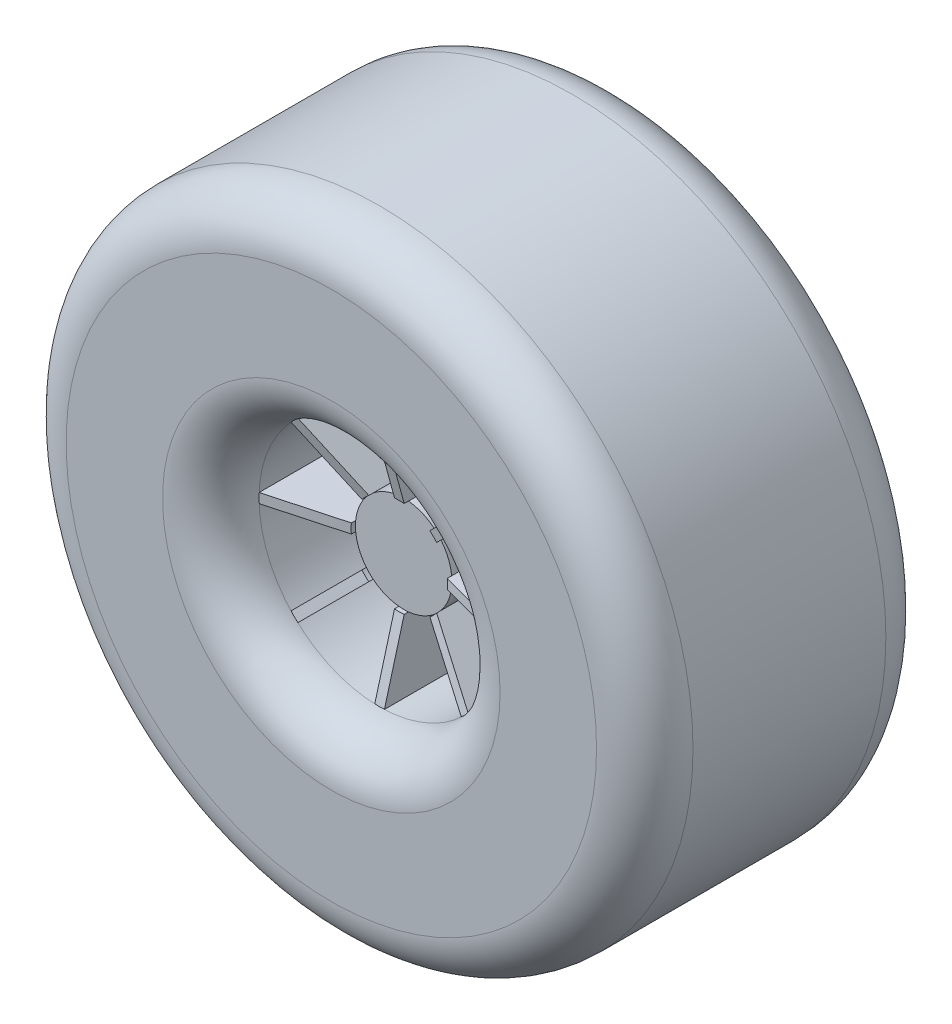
SolidWorks part; units mm, degrees
ref_plane "前视基准面" through (0, 0, 0) normal (0, 0, 1) x (1, 0, 0)
ref_plane "上视基准面" through (0, 0, 0) normal (0, 1, 0) x (1, 0, 0)
ref_plane "右视基准面" through (0, 0, 0) normal (1, 0, 0) x (0, 0, -1)
sketch "草图1" plane through (0, 0, 0) normal (0, 0, 1) x (1, 0, 0)
  circle A0 centre (0, 0) radius 65
  dimension "D1" = 130
extrude "凸台-拉伸1" add sketch "草图1" along normal mid plane 60
sketch "草图4" plane through (0, 0, 30) normal (0, 0, 1) x (1, 0, 0)
  circle A0 centre (0, 0) radius 25
  dimension "D1" = 50
extrude "切除-拉伸1" cut sketch "草图4" against normal blind 60
fillet "圆角1" radius 10 4 edges at (25, 0, -30) (65, 0, -30) (25, 0, 30) (65, 0, 30)
sketch "草图6" plane through (0, 0, 0) normal (0, 0, 1) x (1, 0, 0)
  circle A0 centre (0, 0) radius 10
  dimension "D1" = 20
extrude "凸台-拉伸2" add sketch "草图6" along normal mid plane 30 separate body
sketch "草图7" plane through (0, 0, 0) normal (0, 1, 0) x (1, 0, 0)
  line L0 (-6.6667, 13.5296) -> (-6.6667, -13.5296)
  line L1 (10, 15) -> (-10, 15) construction
  line L2 (-10, -15) -> (10, -15) construction
  line L3 (-10.2561, -15.9789) -> (-22.3772, -19.2847)
  line L4 (65, -20) -> (-65, -20) construction
  line L5 (25, -20) -> (-25, -20) construction
  line L6 (-25, -17.2796) -> (-25, 17.2796)
  line L7 (25, 20) -> (-25, 20) construction
  line L8 (-22.3772, 19.2847) -> (-10.2561, 15.9789)
  line L9 (0, 0) -> (-6.6667, 0) construction
  line L10 (-22.3772, -19.2847) -> (-25, -20)
  line L11 (-25, -20) -> (-25, -17.2796)
  line L12 (-10.2561, -15.9789) -> (-6.6667, -15)
  line L13 (-6.6667, -15) -> (-6.6667, -13.5296)
  line L14 (-6.6667, 13.5296) -> (-6.6667, 15)
  line L15 (-6.6667, 15) -> (-10.2561, 15.9789)
  line L16 (-22.3772, 19.2847) -> (-25, 20)
  line L17 (-25, 20) -> (-25, 17.2796)
  point P16 (-6.6667, -15)
  point P19 (-25, -20)
  point P22 (-25, 20)
  point P25 (-6.6667, 15)
extrude "凸台-拉伸4" add sketch "草图7" along normal mid plane 2
pattern_circular "阵列(圆周)1" count 8 over 360 about axis through (0, 0, 0) along (0, 0, 1) of "凸台-拉伸4"
sketch "草图8" plane through (0, 0, 15) normal (0, 0, 1) x (1, 0, 0)
  circle A0 centre (0, 0) radius 10
  dimension "D1" = 20
extrude "切除-拉伸2" cut sketch "草图8" along normal blind 2
sketch "草图9" plane through (0, 0, -15) normal (0, 0, -1) x (-1, 0, 0)
  circle A0 centre (0, 0) radius 10
  dimension "D1" = 20
extrude "切除-拉伸3" cut sketch "草图9" along normal blind 2
sketch "草图10" plane through (0, 0, -15) normal (0, 0, -1) x (-1, 0, 0)
  line L1 (0, 7.9097) -> (-6.85, 3.9548)
  line L2 (-6.85, 3.9548) -> (-6.85, -3.9548)
  line L3 (-6.85, -3.9548) -> (0, -7.9097)
  line L4 (0, -7.9097) -> (6.85, -3.9548)
  line L5 (6.85, -3.9548) -> (6.85, 3.9548)
  line L6 (6.85, 3.9548) -> (0, 7.9097)
  circle A0 centre (0, 0) radius 6.85 construction
  dimension "D1" = 13.7
extrude "切除-拉伸4" cut sketch "草图10" against normal blind 6
